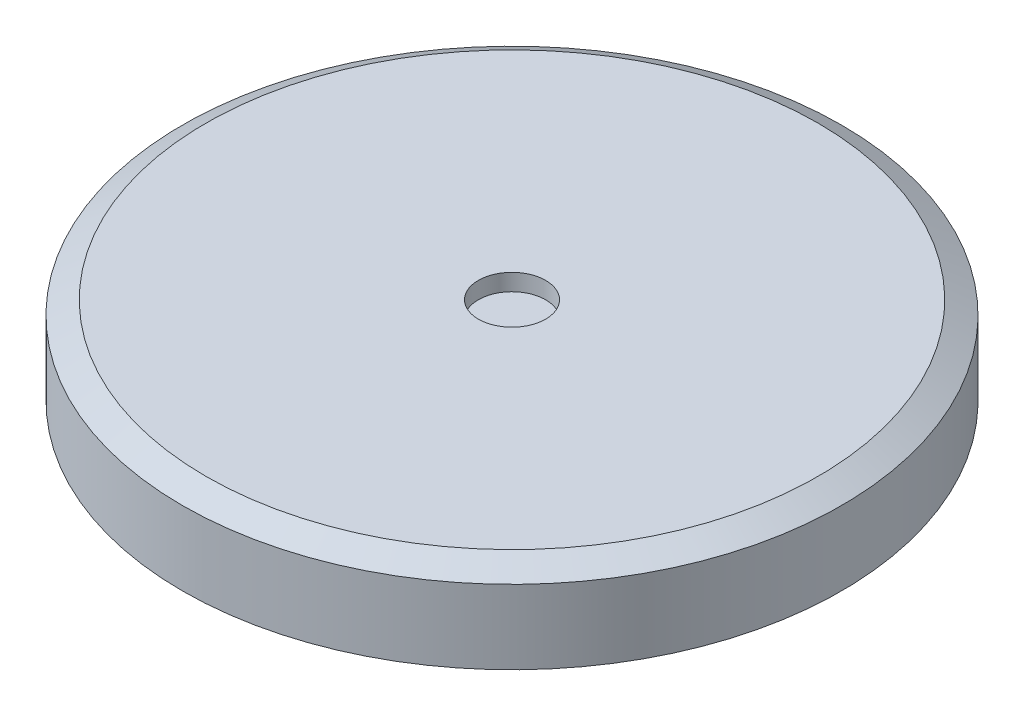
SolidWorks part; units mm, degrees
ref_plane "Plan de face" through (0, 0, 0) normal (0, 0, 1) x (1, 0, 0)
ref_plane "Plan de dessus" through (0, 0, 0) normal (0, 1, 0) x (1, 0, 0)
ref_plane "Plan de droite" through (0, 0, 0) normal (1, 0, 0) x (0, 0, -1)
sketch "Esquisse1" plane through (0, 0, 0) normal (0, 1, 0) x (1, 0, 0)
  circle A0 centre (0, 0) radius 9.8
  dimension "D1" = 19.6
extrude "Extrusion1" add sketch "Esquisse1" along normal blind 3
sketch "Esquisse2" plane through (0, 3, 0) normal (0, 1, 0) x (-1, 0, 0)
  circle A0 centre (0, 0) radius 1
  dimension "D1" = 2
extrude "Enlèv. mat.-Extru.1" cut sketch "Esquisse2" against normal blind 0.5
chamfer "Chanfrein2" distance 0.4 distance2 0.7 1 edges at (0, 3, 9.8)
chamfer "Chanfrein3" distance 0.7 distance2 0.4 1 edges at (0, 0, 9.8)
